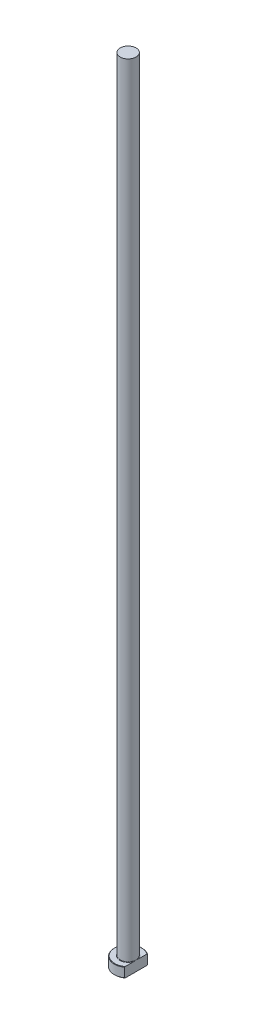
SolidWorks part; units mm, degrees
ref_plane "Front Plane" through (0, 0, 0) normal (0, 0, 1) x (1, 0, 0)
ref_plane "Top Plane" through (0, 0, 0) normal (0, 1, 0) x (1, 0, 0)
ref_plane "Right Plane" through (0, 0, 0) normal (1, 0, 0) x (0, 0, -1)
sketch "Sketch1" plane through (0, 0, 0) normal (0, 0, 1) x (1, 0, 0)
  line L0 (0, 259.9588) -> (0, -15.1925) construction
  line L1 (0, 0) -> (-7, 0)
  line L2 (-7, 0) -> (-7, 5)
  line L3 (-7, 5) -> (-4, 5)
  line L4 (-4, 5) -> (-4, 400)
  line L5 (-4, 400) -> (0, 400)
  line L6 (0, 400) -> (0, 0)
  dimension "L" = 400
  dimension "H" = 14
  dimension "T" = 5
  dimension "D" = 8
revolve "Revolve1" add sketch "Sketch1" angle 360 about L0
chamfer "Chamfer1" distance 0.2 angle 45 2 edges at (0, 5, 7) (0, 0, 7)
fillet "Fillet1" radius 0.2 1 edges at (0, 5, 4)
sketch "Sketch2" plane through (0, 0, 0) normal (0, 1, 0) x (1, 0, 0)
  line L0 (4, 5.7446) -> (4, -5.7446)
  circle A0 centre (0, 0) radius 7 construction
  arc A1 (4, -5.7446) -> (4, 5.7446) centre (0, 0) ccw
  circle A2 centre (0, 0) radius 4 construction
extrude "KEY" cut sketch "Sketch2" along normal through all
